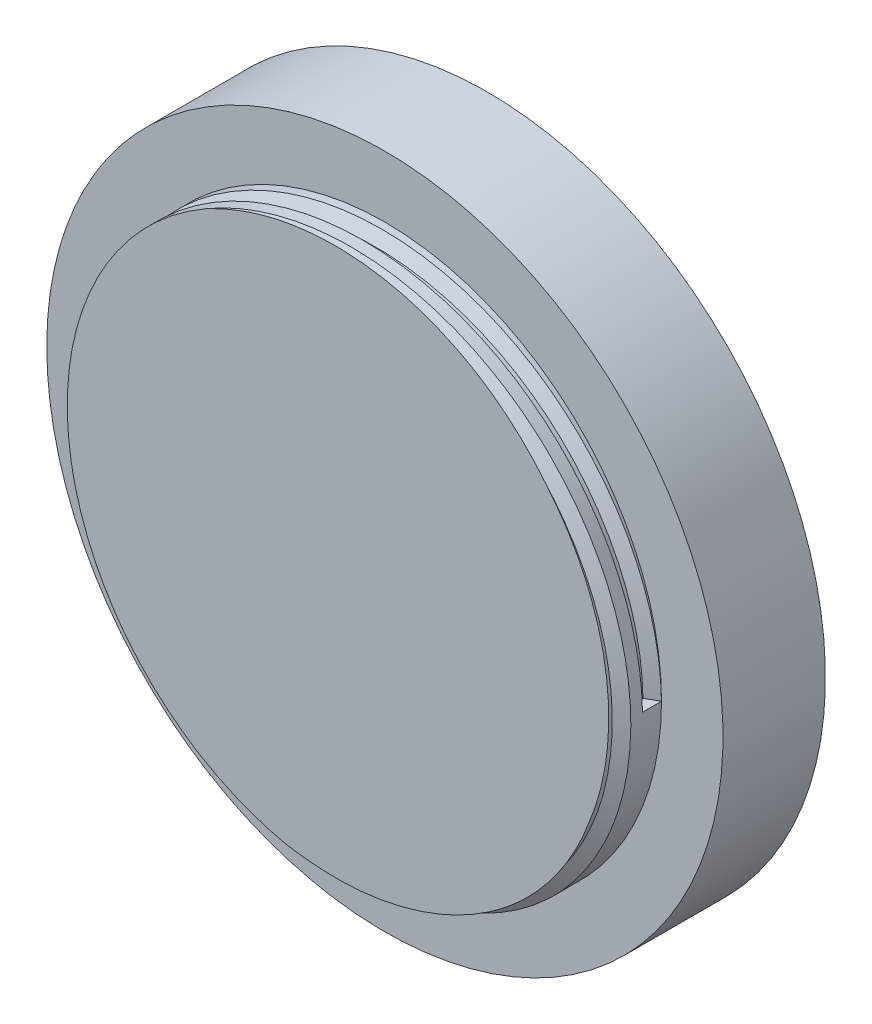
SolidWorks part; units mm, degrees
ref_plane "前视基准面" through (0, 0, 0) normal (0, 0, 1) x (1, 0, 0)
ref_plane "上视基准面" through (0, 0, 0) normal (0, 1, 0) x (1, 0, 0)
ref_plane "右视基准面" through (0, 0, 0) normal (1, 0, 0) x (0, 0, -1)
sketch "草图1" plane through (0, 0, 0) normal (0, 0, 1) x (1, 0, 0)
  circle A0 centre (0, 0) radius 13.5
extrude "凸台-拉伸1" add sketch "草图1" along normal blind 2
sketch "草图2" plane through (0, 0, 0) normal (0, 0, -1) x (-1, 0, 0)
  circle A0 centre (0, 0) radius 16.5
extrude "凸台-拉伸2" add sketch "草图2" along normal blind 5
thread "螺纹线2" pitch 1.0583 start angle 0, offset 0, length 0, pitch 1.5, diameter 27
ref_plane "基准面6" through (13.5, 0, 0) normal (0, -1, 0) x (1, 0, 0)
sketch "螺纹线轮廓3" plane through (13.5, 0, 0) normal (0, -1, 0) x (1, 0, 0)
  line L0 (0, 0) -> (0, 1.0583) construction
  line L11 (0, 0) -> (0, 0.926)
  line L12 (0, 0.926) -> (-0.5728, 0.5953)
  line L13 (-0.5728, 0.5953) -> (-0.5728, 0.3307)
  line L15 (-0.5728, 0.3307) -> (0, 0)
  line L17 (-0.5728, 0.463) -> (0, 0.463) construction
  point P2 (0, 0)
  dimension "Pitch" = 1.0583
  dimension "Profile_Angle" = 60
  dimension "Profile_Land" = 0.2646
  dimension "Profile_Height" = 0.5728
